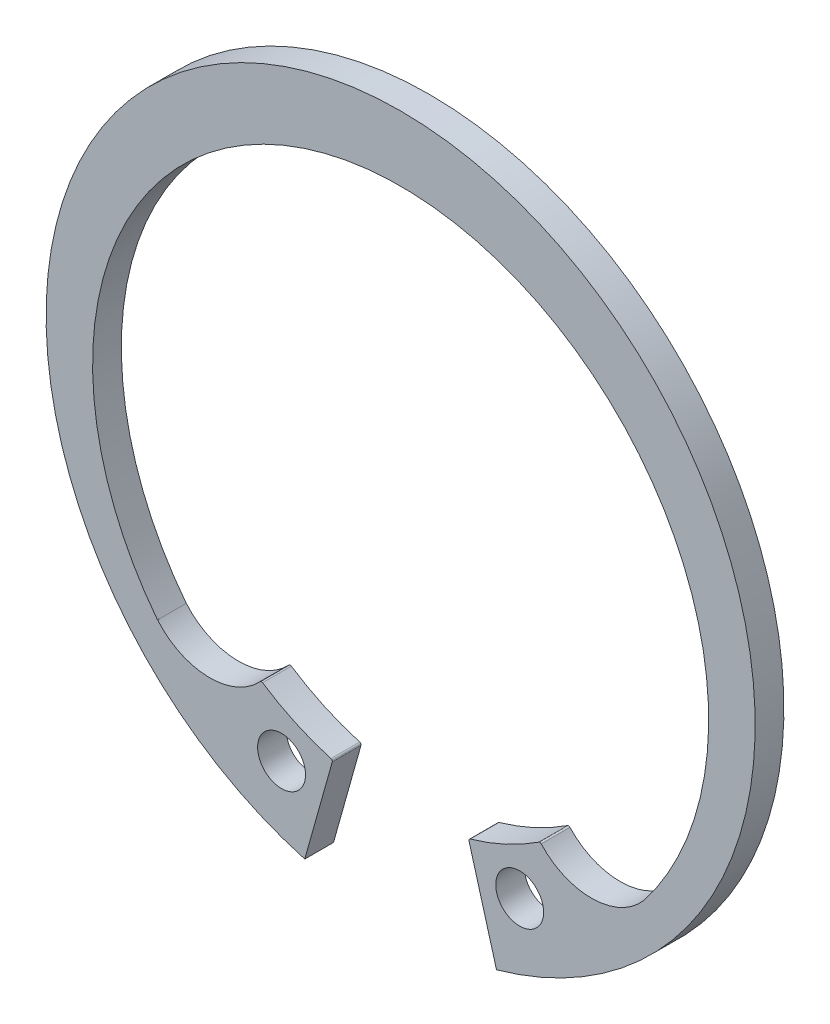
SolidWorks part; units mm, degrees
extrude "Body" add sketch "BodySke" against normal blind 1.5
sketch "BodySke" plane through (0, 0, 0) normal (0, 0, 1) x (1, 0, 0)
  line L0 (-1.5431, 0) -> (1.5431, 0) construction
  line L1 (0, 0) -> (0, 15.1) construction
  line L2 (5.0027, -17.8107) -> (4.0944, -14.5769)
  line L3 (-5.0027, -17.8107) -> (-4.0944, -14.5769)
  line L4 (0, 0) -> (12.0561, -14.0322) construction
  line L5 (0, 0) -> (-12.0561, -14.0322) construction
  line L6 (-5.8744, -12.7785) -> (-6.5505, -15.1854) construction
  line L7 (6.0095, -13.2593) -> (6.4154, -14.7046) construction
  arc A0 (-4.0944, -14.5769) -> (-7.8628, -12.5272) centre (-6.2124, -13.982) ccw
  arc A1 (7.8628, -12.5272) -> (4.0944, -14.5769) centre (6.2124, -13.982) ccw
  arc A2 (10.9482, -12.7427) -> (-10.9482, -12.7427) centre (0, -0.9739) ccw construction
  arc A3 (5.0027, -17.8107) -> (-5.0027, -17.8107) centre (0, 0) ccw
  circle A4 centre (6.2124, -13.982) radius 1.25
  circle A5 centre (-6.2124, -13.982) radius 1.25
  circle A6 centre (6.2124, -13.982) radius 2.2 construction
  arc A7 (11.0217, -12.6739) -> (-11.0217, -12.6739) centre (0, -0.9739) ccw
  arc A8 (-6.2124, -13.982) -> (6.2124, -13.982) centre (0, 0) ccw construction
  arc A9 (-11.0217, -12.6739) -> (-7.8628, -12.5272) centre (-9.5132, -11.0725) ccw
  arc A10 (7.8628, -12.5272) -> (11.0217, -12.6739) centre (9.5132, -11.0725) ccw
ref_plane "Plane1" through (0, 0, 0) normal (0, 0, 1) x (1, 0, 0)
ref_plane "Plane2" through (0, 0, 0) normal (0, 1, 0) x (1, 0, 0)
ref_plane "Plane3" through (0, 0, 0) normal (1, 0, 0) x (0, 0, -1)
sketch "Clipboard" plane through (0, 0, 0) normal (0, 0, 1) x (1, 0, 0)
  line L0 (0, 0) -> (3.4, 0)
  line L1 (0, 0) -> (0, 1.7)
  line L2 (0, 0) -> (0, -5.4)
  circle A0 centre (0, 0) radius 1.25
  circle A1 centre (0, 0) radius 17.5
sketch "ModLugSke" plane through (0, 0, 0) normal (0, 0, 1) x (1, 0, 0)
  line L0 (5.0027, -17.8107) -> (3.5694, -12.7078)
  line L1 (-5.0027, -17.8107) -> (-3.5694, -12.7078)
  line L2 (9.957, -8.5128) -> (14.0614, -12.0219) construction
  line L3 (-9.957, -8.5128) -> (-14.0614, -12.0219) construction
  line L4 (-5.0027, -17.8107) -> (-4.0944, -14.5769) construction
  line L5 (4.0944, -14.5769) -> (5.0027, -17.8107) construction
  line L6 (0, 0) -> (0, -18.0732) construction
  line L7 (12.6817, -10.8423) -> (14.0614, -12.0219)
  line L8 (-14.0614, -12.0219) -> (-12.6817, -10.8423)
  arc A0 (5.0027, -17.8107) -> (14.0614, -12.0219) centre (0, 0) ccw
  arc A1 (-7.2054, -10.9404) -> (-3.6379, -12.5847) centre (0, 0) ccw
  arc A2 (5.0027, -17.8107) -> (-5.0027, -17.8107) centre (0, 0) ccw construction
  arc A3 (7.8628, -12.5272) -> (4.0944, -14.5769) centre (6.2124, -13.982) ccw construction
  arc A4 (-7.2054, -10.9404) -> (-7.3336, -10.9558) centre (-7.2604, -11.0239) ccw
  arc A5 (-12.6817, -10.8423) -> (-7.3336, -10.9558) centre (-9.957, -8.5128) ccw
  arc A6 (11.0217, -12.6739) -> (-11.0217, -12.6739) centre (0, -0.9739) ccw construction
  arc A7 (7.3336, -10.9558) -> (12.6817, -10.8423) centre (9.957, -8.5128) ccw
  arc A8 (3.6379, -12.5847) -> (7.2054, -10.9404) centre (0, 0) ccw
  arc A9 (-14.0614, -12.0219) -> (-5.0027, -17.8107) centre (0, 0) ccw
  circle A10 centre (-6.2124, -13.982) radius 1.25
  circle A11 centre (-6.2124, -13.982) radius 1.25 construction
  circle A12 centre (6.2124, -13.982) radius 1.25
  circle A13 centre (6.2124, -13.982) radius 1.25 construction
  arc A14 (-3.6379, -12.5847) -> (-3.5694, -12.7078) centre (-3.6657, -12.6808) cw
  arc A15 (3.6379, -12.5847) -> (3.5694, -12.7078) centre (3.6657, -12.6808) ccw
  arc A16 (7.2054, -10.9404) -> (7.3336, -10.9558) centre (7.2604, -11.0239) cw
  point P43 (3.5425, -12.6119)
extrude "ModLug" add sketch "ModLugSke" against normal through all
sketch "UnlSke" [suppressed] plane through (0, 0, 0) normal (0, 0, 1) x (1, 0, 0)
  line L0 (2.1178, -8.3352) -> (3.2259, -12.6966)
  line L1 (-2.1178, -8.3352) -> (-3.2259, -12.6966)
  line L2 (-3.2259, -12.6966) -> (-2.1422, -8.4315) construction
  line L3 (2.1422, -8.4315) -> (3.2259, -12.6966) construction
  arc A0 (2.1178, -8.3352) -> (-2.1178, -8.3352) centre (0, 0) ccw
  arc A1 (3.2259, -12.6966) -> (-3.2259, -12.6966) centre (0, 0) ccw
  arc A2 (3.2259, -12.6966) -> (-3.2259, -12.6966) centre (0, 0) ccw construction
  circle A4 centre (-4.4431, -9.5688) radius 1
  circle A5 centre (4.4431, -9.5688) radius 1
  circle A6 centre (4.4431, -9.5688) radius 1 construction
  circle A7 centre (-4.4431, -9.5688) radius 1 construction
  arc A8 (2.2134, -8.3103) -> (4.9183, -7.0548) centre (0, 0) ccw construction
extrude "Unlug" [suppressed] add sketch "UnlSke" against normal through all
equation "' \"BoreDia@Clipboard\" = 8"
equation "' \"Thickness@Body\" = 0.8"
equation "' \"GrooveDia@BodySke\" = 8.4"
equation "' \"LugSection@Clipboard\" = 2.4"
equation "' \"LargeSection@Clipboard\" = 1.1"
equation "' \"HoleDia@Clipboard\" = 1.0"
equation "' \"BoreDia@Clipboard\" = 25"
equation "' \"Thickness@Body\" = 1.2"
equation "' \"GrooveDia@BodySke\" = 26.2"
equation "' \"LugSection@Clipboard\" = 4.5"
equation "' \"LargeSection@Clipboard\" = 2.7"
equation "' \"HoleDia@Clipboard\" = 2"
equation "\"SmallSection@Clipboard\" = \"LargeSection@Clipboard\" * 0.5"
equation "\"TipRad@BodySke\" = (\"LugSection@Clipboard\" - (\"GrooveDia@BodySke\" / 2  -  \"BoreDia@Clipboard\" / 2 ) ) / 2"
equation "\"HoleOffsetRad@BodySke\" = (\"GrooveDia@BodySke\" / 2) - \"LugSection@Clipboard\"  + \"TipRad@BodySke\""
equation "\"LargeRad@BodySke\" =  \"GrooveDia@BodySke\" / 2 -  \"LargeSection@Clipboard\""
equation "\"SmallRad@BodySke\" =  \"GrooveDia@BodySke\" / 2 -  \"SmallSection@Clipboard\""
equation "\"HoleDia@BodySke\" =  \"HoleDia@Clipboard\""
equation "\"FilletRad@BodySke\" = \"TipRad@BodySke\" * 1.0"
equation "\"GapAngle@BodySke\" = 360 - 0.965 * 360 * ( \"BoreDia@Clipboard\" /  \"GrooveDia@BodySke\")"
equation "\"LugAng@ModLugSke\" = \"GapAngle@BodySke\"  + 2 * 360 * (\"LugSection@Clipboard\" / (\"BoreDia@Clipboard\" * 3.1416))"
